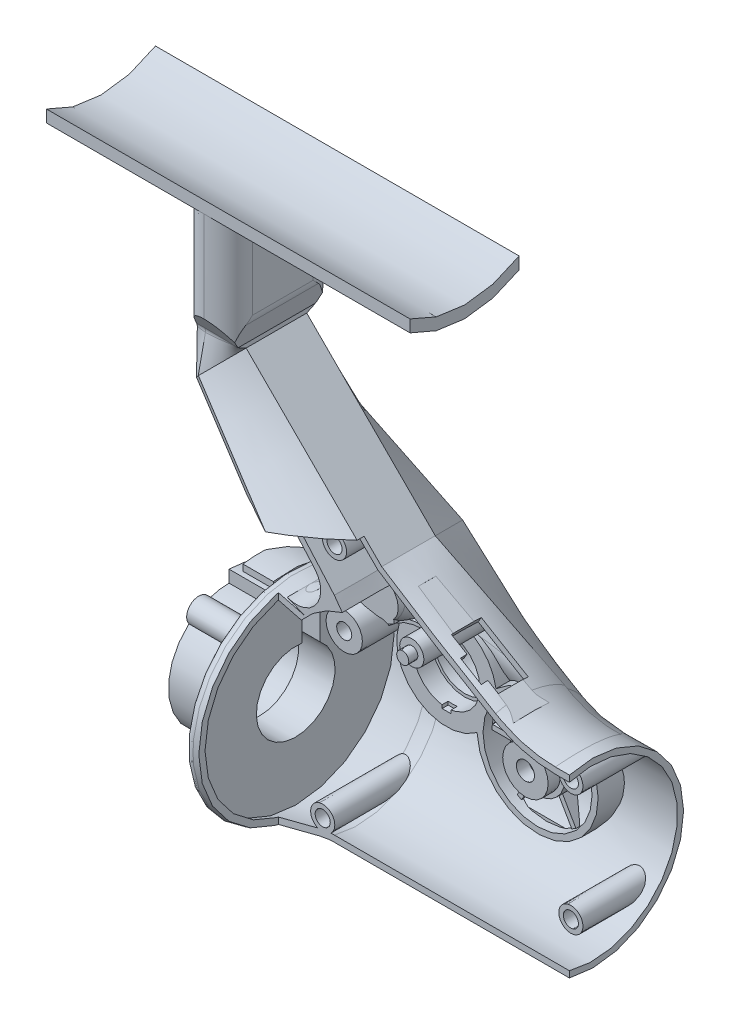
SolidWorks part; units mm, degrees
ref_plane "Plan1" through (0, 0, 0) normal (0, 0, 1) x (1, 0, 0)
ref_plane "Plan2" through (0, 0, 0) normal (0, 1, 0) x (1, 0, 0)
ref_plane "Plan3" through (0, 0, 0) normal (1, 0, 0) x (0, 0, -1)
sketch "Esquisse1" plane through (0, 0, 0) normal (0, 1, 0) x (1, 0, 0)
  line L0 (-80, -50) -> (-80, 50) construction
ref_plane "Plan5" through (-40, 40, 0) normal (-0.7071, 0.7071, 0) x (0, 0, 1)
ref_plane "Plan6" through (-61.2132, 61.2132, 0) normal (-0.7071, 0.7071, 0) x (0, 0, 1)
sketch "Esquisse2" plane through (-61.2132, 61.2132, 0) normal (-0.7071, 0.7071, 0) x (0, 0, 1)
  line L0 (-2.8446, 83.5777) -> (-12.8446, 83.5777)
  line L1 (-1.8446, 73.3764) -> (-13.8446, 73.3764)
  line L2 (-13.8446, 73.3764) -> (-15.3403, 75.977)
  line L3 (-15.3403, 75.977) -> (-12.8446, 83.5777)
  line L4 (-1.8446, 73.3764) -> (-0.3489, 75.977)
  line L5 (-0.3489, 75.977) -> (-2.8446, 83.5777)
  line L6 (-2.8446, 83.5777) -> (-13.8446, 73.3764) construction
  line L7 (-12.8446, 83.5777) -> (-1.8446, 73.3764) construction
  dimension "D1" = 12
  dimension "D2" = 10
  dimension "D3" = 8
  dimension "D4" = 3
  dimension "D5" = 8
  dimension "D6" = 3
sketch "Esquisse3" plane through (-40, 40, 0) normal (-0.7071, 0.7071, 0) x (0, 0, 1)
  line L0 (-2.8446, 83.5777) -> (-12.8446, 83.5777)
  line L1 (-12.8446, 83.5777) -> (-21.218, 78.1109)
  line L2 (-2.8446, 83.5777) -> (5.5288, 78.1109)
  line L3 (5.5288, 78.1109) -> (1.1554, 71.4122)
  line L4 (-21.218, 78.1109) -> (-16.8446, 71.4122)
  line L5 (-16.8446, 71.4122) -> (1.1554, 71.4122)
  line L6 (-2.8446, 83.5777) -> (-16.8446, 71.4122) construction
  line L7 (-12.8446, 83.5777) -> (1.1554, 71.4122) construction
  dimension "D1" = 10
  dimension "D2" = 10
  dimension "D3" = 8
  dimension "D4" = 8
  dimension "D5" = 18
loft "Base-Lissage" add profiles "Esquisse3", "Esquisse2"
ref_plane "Plan7" through (50.07, 0, 0) normal (1, 0, 0) x (0, 0, -1)
ref_plane "Plan8" through (0.07, 0, 0) normal (1, 0, 0) x (0, 0, -1)
sketch "Esquisse4" plane through (50.07, 0, 0) normal (1, 0, 0) x (0, 0, -1)
  circle A0 centre (7.8446, 70.3116) radius 15
  dimension "D1" = 30
  dimension "D2" = 9
  dimension "D3" = 50
sketch "Esquisse5" plane through (0.07, 0, 0) normal (1, 0, 0) x (0, 0, -1)
  circle A0 centre (7.8446, 70.3116) radius 17.5
  dimension "D1" = 35
ref_plane "Plan9" through (-15.2513, 15.2513, 0) normal (-0.7071, 0.7071, 0) x (0, 0, 1)
sketch "Esquisse8" plane through (-40, 40, 0) normal (0.7071, -0.7071, 0) x (0, 0, -1)
  line L0 (2.8446, 83.5777) -> (12.8446, 83.5777)
  line L1 (12.8446, 83.5777) -> (21.218, 78.1109)
  line L2 (2.8446, 83.5777) -> (-5.5288, 78.1109)
  line L3 (-5.5288, 78.1109) -> (-1.1554, 71.4122)
  line L4 (-1.1554, 71.4122) -> (16.8446, 71.4122)
  line L5 (16.8446, 71.4122) -> (21.218, 78.1109)
ref_plane "Plan10" through (10.07, 0, 0) normal (1, 0, 0) x (0, 0, -1)
sketch "Esquisse9" plane through (10.07, 0, 0) normal (1, 0, 0) x (0, 0, -1)
  circle A0 centre (7.8446, 70.3116) radius 15
  dimension "D1" = 30
sketch "Esquisse10" plane through (-40, 40, 0) normal (-0.7071, 0.7071, 0) x (0, 0, 1)
  line L0 (-2.8446, 83.5777) -> (-12.8446, 83.5777)
  line L1 (-2.8446, 83.5777) -> (5.5288, 78.1109)
  line L2 (5.5288, 78.1109) -> (1.1554, 71.4122)
  line L3 (1.1554, 71.4122) -> (-16.8446, 71.4122)
  line L4 (-16.8446, 71.4122) -> (-21.218, 78.1109)
  line L5 (-21.218, 78.1109) -> (-12.8446, 83.5777)
ref_plane "Plan11" through (0, 0, -8) normal (0, 0, 1) x (1, 0, 0)
sketch "Esquisse12" plane through (-15.2513, 15.2513, 0) normal (-0.7071, 0.7071, 0) x (0, 0, 1)
  circle A0 centre (-7.8446, 78.5777) radius 14.1421
  dimension "D1" = 9
  dimension "D2" = 5
loft "Boss.-Lissage1" add profiles "Esquisse12", "Esquisse10"
extrude "Boss.-Extru.2" add sketch "Esquisse9" along normal blind 40
sketch "Esquisse13" plane through (50.07, 0, 0) normal (1, 0, 0) x (0, 0, -1)
  circle A0 centre (7.8446, 70.3116) radius 15.94
extrude "Enlèv. mat.-Extru.1" cut sketch "Esquisse13" along normal blind 50
sketch "Esquisse14" plane through (10.07, 0, 0) normal (-1, 0, 0) x (0, 0, 1)
  circle A0 centre (-7.8446, 70.3116) radius 15
loft "Boss.-Lissage2" add profiles "Esquisse14", "Esquisse5"
fillet "Congé1" radius 10 1 edges at (10.07, 70.3116, 7.1554)
fillet "Congé3" radius 2 1 edges at (14.7265, 86.0336, -17.3)
fillet "Congé5" radius 20 3 edges at (37.8522, 77.0931, 5.5349) (42.6261, 85.2861, -8.7175) (38.4144, 77.6533, -20.925)
fillet "Congé9" radius 3 4 edges at (26.591, 78.6949, -20.2832) (23.0539, 80.0645, 3.5519) (15.967, 83.8004, -17.0589) (36.2035, 75.8986, 6.179)
shell "Coque2" thickness 1
ref_plane "Plan12" through (0, 125, 0) normal (0, 1, 0) x (-1, 0, 0)
ref_plane "Plan13" through (0, 121, 0) normal (0, 1, 0) x (-1, 0, 0)
sketch "Esquisse15" plane through (-61.2132, 61.2132, 0) normal (-0.7071, 0.7071, 0) x (0, 0, 1)
  line L0 (-12.8446, 83.5777) -> (-2.8446, 83.5777)
  line L1 (-2.8446, 83.5777) -> (-0.3343, 75.9412)
  line L2 (-0.3343, 75.9412) -> (-1.5264, 73.7426)
  line L3 (-12.8446, 83.5777) -> (1.1554, 71.4122) construction
  line L4 (-1.5264, 73.7426) -> (-14.1628, 73.7426)
  line L5 (-2.8446, 83.5777) -> (-16.8446, 71.4122) construction
  line L6 (-14.1628, 73.7426) -> (-15.44, 75.9412)
  line L7 (-15.44, 75.9412) -> (-12.8446, 83.5777)
  ellipse E0 centre (-7.8446, 85.1226) end of major axis (-22.8446, 85.1226) minor radius 10.6066 construction
sketch "Esquisse16" plane through (0, 125, 0) normal (0, 1, 0) x (-1, 0, 0)
  line L0 (-50.07, -7.8446) -> (-11.3011, -7.8446) construction
  line L1 (9.0693, -16.8446) -> (1.0693, -16.8446)
  line L2 (9.0693, -16.8446) -> (9.0693, 1.1554)
  line L3 (9.0693, 1.1554) -> (1.0693, 1.1554)
  line L4 (1.0693, -16.8446) -> (1.0693, 1.1554)
  dimension "D1" = 8
  dimension "D2" = 18
  dimension "D3" = 9
  dimension "D4" = 8
sketch "Esquisse17" plane through (0, 121, 0) normal (0, 1, 0) x (-1, 0, 0)
  line L1 (9.0693, -1.5264) -> (2.1241, -1.5264)
  line L2 (9.0693, -1.5264) -> (9.0693, -14.3145)
  line L3 (9.0693, -14.3145) -> (2.1241, -14.3145)
  line L4 (2.1241, -1.5264) -> (2.1241, -14.3145)
loft "Boss.-Lissage5" add profiles "Esquisse15", "Esquisse17"
sketch "Esquisse18" plane through (0, 121, 0) normal (0, 1, 0) x (-1, 0, 0)
  line L0 (9.0693, -16.8446) -> (9.0693, 1.1554) construction
  line L1 (9.0693, -14.3145) -> (2.1241, -14.3145)
  line L2 (9.0693, -14.3145) -> (9.0693, -1.5264)
  line L3 (9.0693, -1.5264) -> (2.1241, -1.5264)
  line L4 (2.1241, -14.3145) -> (2.1241, -1.5264)
loft "Boss.-Lissage6" add profiles "Esquisse18", "Esquisse16"
sketch "Esquisse19" plane through (0, 125, 0) normal (0, 1, 0) x (-1, 0, 0)
  line L1 (9.0693, 1.1554) -> (1.0693, 1.1554)
  line L2 (9.0693, 1.1554) -> (9.0693, -16.8446)
  line L3 (9.0693, -16.8446) -> (1.0693, -16.8446)
  line L4 (1.0693, 1.1554) -> (1.0693, -16.8446)
extrude "Boss.-Extru.6" add sketch "Esquisse19" along normal blind 15
sketch "Esquisse20" plane through (-1.0693, 0, 0) normal (1, 0, 0) x (0, 0, -1)
  line L1 (-1.1554, 140) -> (16.8446, 140) construction
  line L2 (-1.1554, 140) -> (-1.1554, 141.995)
  line L3 (16.8446, 141.995) -> (-1.1554, 141.995)
  line L4 (16.8446, 141.995) -> (16.8446, 140)
  arc A0 (16.8446, 140) -> (-1.1554, 140) centre (7.8446, 155) cw
  dimension "D2" = 18
  dimension "D3" = 15
extrude "Boss.-Extru.7" add sketch "Esquisse20" along normal mid plane 60
sketch "Esquisse21" plane through (28.9307, 0, 0) normal (1, 0, 0) x (0, 0, -1)
  line L1 (-1.1554, 141.995) -> (0, 150)
  line L2 (0, 150) -> (20.3442, 147.0636)
  line L3 (20.3442, 147.0636) -> (16.8446, 141.995)
  arc A0 (16.8446, 141.995) -> (-1.1554, 141.995) centre (7.8446, 156.9022) cw
extrude "Enlèv. mat.-Extru.2" cut sketch "Esquisse21" against normal through all
fillet "Congé32" radius 4 12 edges at (-9.0693, 117.1785, -1.5264) (-5.0693, 125, 1.1554) (-5.0693, 125, -16.8446) (-9.0693, 123, -0.1855) (-9.0693, 123, -15.5795) (-9.0693, 132.5, -16.8446) (-9.0693, 132.5, 1.1554) (-1.0693, 132.5, 1.1554) (-1.0693, 132.5, -16.8446)
fillet "Congé36" radius 1 6 edges at (-5.4568, 121, -14.3145) (-7.3188, 123.9052, -16.1521) (-8.824, 118.4998, -1.4653)
fillet "Congé37" radius 4 2 edges at (-1.0693, 125, -7.8446) (-1.2457, 124.3311, -1.6699)
sketch "Esquisse22" plane through (0.07, 0, 0) normal (-1, 0, 0) x (0, 0, 1)
  circle A0 centre (-7.8446, 70.3116) radius 10
  dimension "D1" = 20
extrude "Boss.-Extru.8" add sketch "Esquisse22" along normal blind 10
sketch "Esquisse23" plane through (-9.93, 0, 0) normal (-1, 0, 0) x (0, 0, 1)
  line L2 (-12.8446, 81.2203) -> (-12.8446, 70.3116)
  line L3 (-12.8446, 70.3116) -> (-7.8446, 70.3116)
  line L4 (-7.8446, 82.3116) -> (-7.8446, 70.3116)
  circle A0 centre (-2.8446, 78.9718) radius 2
  circle A1 centre (-7.8446, 70.3116) radius 10 construction
  circle A2 centre (-12.8446, 61.6513) radius 2
  circle A3 centre (-7.8446, 70.3116) radius 12 construction
  arc A4 (-7.8446, 82.3116) -> (-12.8446, 81.2203) centre (-7.8446, 70.3116) ccw
  dimension "D1" = 4
  dimension "D2" = 4
  dimension "D4" = 24
  dimension "D3" = 5
  dimension "D5" = 5
  dimension "D6" = 5
extrude "Boss.-Extru.9" add sketch "Esquisse23" against normal up to next
sketch "Esquisse24" plane through (-9.93, 0, 0) normal (-1, 0, 0) x (0, 0, 1)
  line L0 (-8.8446, 81.2193) -> (-8.8446, 76.7342)
  line L1 (-11.8446, 81.2193) -> (-8.8446, 81.2193)
  line L2 (-11.8446, 81.2193) -> (-11.8446, 75.435)
  arc A0 (-11.8446, 75.435) -> (-8.8446, 76.7342) centre (-7.8446, 70.3116) ccw
  dimension "D1" = 6.5
  dimension "D3" = 1
  dimension "D4" = 3
  dimension "D5" = 0.001
extrude "Enlèv. mat.-Extru.3" cut sketch "Esquisse24" against normal blind 15
sketch "Esquisse25" plane through (-9.93, 0, 0) normal (-1, 0, 0) x (0, 0, 1)
  circle A0 centre (-2.8446, 78.9718) radius 1.25
  circle A1 centre (-12.8446, 61.6513) radius 1.25
  circle A2 centre (-7.8446, 70.3116) radius 7
  dimension "D1" = 2.5
  dimension "D2" = 2.5
  dimension "D3" = 14
extrude "Enlèv. mat.-Extru.4" cut sketch "Esquisse25" against normal blind 5
fillet "Congé38" radius 1 9 edges at (0.07, 80.1812, -6.2353) (0.07, 80.7039, -1.8446) (0.07, 65.3116, 0.8157) (0.07, 59.9193, -13.8446) (0.07, 71.3116, -17.7945) (0.07, 80.0961, -12.8446) (0.07, 81.3116, -7.8446) (0.07, 82.0356, -10.4034) (0.07, 70.3116, -25.3446)
sketch "Esquisse26" plane through (0.07, 0, 0) normal (-1, 0, 0) x (0, 0, 1)
  line L0 (-5.1428, 86.8918) -> (-5.1428, 85.8478)
  line L1 (-20.9141, 79.1355) -> (-22.1395, 79.1355)
  arc A0 (-5.1428, 86.8918) -> (-22.1395, 79.1355) centre (-7.8446, 70.3116) ccw
  arc A1 (-5.1428, 85.8478) -> (-20.9141, 79.1355) centre (-7.8446, 70.3116) ccw
extrude "Boss.-Extru.10" add sketch "Esquisse26" along normal blind 5
ref_plane "Plan14" through (0, 88.6889, 0) normal (0, 1, 0) x (-1, 0, 0)
sketch "Esquisse27" plane through (0, 88.6889, 0) normal (0, 1, 0) x (-1, 0, 0)
  line L0 (4.93, -8.8446) -> (-0.07, -22.1395)
  line L1 (4.93, -8.8446) -> (4.93, -22.1395)
  line L2 (4.93, -22.1395) -> (-0.07, -22.1395)
  line L3 (4.93, -14.8446) -> (4.93, -0.8446) construction
  point P6 (4.93, -7.8446)
  dimension "D1" = 1
extrude "Enlèv. mat.-Extru.5" cut sketch "Esquisse27" against normal up to surface (35.5975 mm away)
fillet "Congé44" radius 1 1 edges at (-2.3582, 83.995, -15.6828)
sketch "Esquisse28" plane through (0, 0, -8) normal (0, 0, 1) x (1, 0, 0)
  line L0 (1.07, 70.3116) -> (-4.93, 70.3116) construction
  line L1 (1.3125, 53.1222) -> (1.3125, 87.5009) construction
  line L3 (50.07, 70.3116) -> (11.3011, 70.3116) construction
  circle A0 centre (31.3125, 70.3116) radius 4.5
  circle A1 centre (46.3125, 80.3116) radius 2
  circle A2 centre (46.3125, 60.3116) radius 2
  circle A3 centre (11.3125, 98.3116) radius 2
  circle A4 centre (9.3666, 58.3116) radius 2
  circle A5 centre (16.3125, 76.3116) radius 5
  circle A6 centre (46.3125, 80.3116) radius 1.25
  circle A7 centre (46.3125, 60.3116) radius 1.25
  circle A8 centre (9.3666, 58.3116) radius 1.25
  circle A9 centre (11.3125, 98.3116) radius 1.25
  dimension "D1" = 9
  dimension "D3" = 4
  dimension "D4" = 4
  dimension "D7" = 4
  dimension "D8" = 4
  dimension "D14" = 10
  dimension "D17" = 2.5
  dimension "D18" = 2.5
  dimension "D19" = 2.5
  dimension "D20" = 2.5
  dimension "D2" = 30
  dimension "D5" = 20
  dimension "D6" = 15
  dimension "D9" = 28
  dimension "D10" = 15
  dimension "D11" = 10
  dimension "D12" = 20
  dimension "D13" = 12
  dimension "D15" = 6
  dimension "D16" = 15
extrude "Boss.-Extru.12" add sketch "Esquisse28" along normal up to next and the other way up to next
sketch "Esquisse31" plane through (0, 0, -8) normal (0, 0, 1) x (1, 0, 0)
  line L0 (-9.3283, 113.0982) -> (10.496, 90.496) construction
  line L1 (8.8757, 85.6101) -> (1.3125, 87.5009) construction
  line L2 (8.0029, 93.3385) -> (12.9057, 87.9542)
  line L3 (10.496, 90.496) -> (15.3153, 85.4124) construction
  line L4 (3.5116, 86.9512) -> (13.1986, 82.9294)
  line L5 (13.1986, 82.9294) -> (12.8811, 87.4325)
  line L6 (12.9057, 87.9542) -> (12.8811, 87.4325)
  arc A0 (8.0029, 93.3385) -> (3.5116, 86.9512) centre (5.0453, 90.6454) cw
  spline S0 degree 3 poles (16.2369, 80.9616) (15.7292, 81.2771) (15.2385, 81.5873) (14.2964, 82.1941) (13.8431, 82.4898) (13.2062, 82.9231) (13.001, 83.0657) (12.6064, 83.3462) (12.4161, 83.4848) (11.8797, 83.8843) (11.5671, 84.13) (11.3011, 84.3485) knots 0 0 0 0 0.25 0.25 0.5 0.5 0.625 0.625 0.75 0.75 1 1 1 1 construction
  dimension "D1" = 4
extrude "Boss.-Extru.18" add sketch "Esquisse31" along normal mid plane 10
sketch "Esquisse34" plane through (0, 0, -8) normal (0, 0, 1) x (1, 0, 0)
  line L0 (15.6094, 89.7932) -> (15.6094, 84.496)
  line L1 (15.6094, 84.496) -> (6.9254, 76.3356)
  line L2 (6.9254, 76.3356) -> (2.9541, 78.2614)
  arc A0 (15.6094, 89.7932) -> (2.9541, 78.2614) centre (16.3125, 76.3116) ccw
  dimension "D1" = 13.5
extrude "Enlèv. mat.-Extru.6" cut sketch "Esquisse34" against normal mid plane 8
ref_plane "Plan15" through (0, 0, -4) normal (0, 0, 1) x (1, 0, 0)
sketch "Esquisse35" plane through (0, 0, -4) normal (0, 0, 1) x (1, 0, 0)
  line L0 (2.07, 22) -> (2.07, 95.7944)
  line L1 (20.1041, 50.6066) -> (-50.6066, -20.1041) construction
  line L2 (2.07, 22) -> (71.4975, 22)
  line L3 (2.07, 102) -> (-7.4894, 102)
  line L4 (2.07, 102) -> (71.4975, 102)
  line L5 (71.4975, 22) -> (71.4975, 102)
  line L6 (50.07, 55.3116) -> (50.07, 85.3116) construction
  line L7 (-7.4894, 102) -> (-7.4894, 95.7944)
  line L8 (-7.4894, 95.7944) -> (2.07, 95.7944)
  dimension "D1" = 80
  dimension "D2" = 22
  dimension "D3" = 48
extrude "Enlèv. mat.-Extru.7" cut sketch "Esquisse35" along normal blind 23
sketch "Esquisse36" plane through (0, 0, -4) normal (0, 0, 1) x (1, 0, 0)
  circle A0 centre (16.3125, 76.3116) radius 8.25
  dimension "D1" = 16.5
extrude "Boss.-Extru.19" add sketch "Esquisse36" against normal blind 21
sketch "Esquisse37" plane through (0, 0, -4) normal (0, 0, 1) x (1, 0, 0)
  circle A0 centre (16.3125, 76.3116) radius 5
  dimension "D1" = 10
extrude "Enlèv. mat.-Extru.8" cut sketch "Esquisse37" against normal through all
sketch "Esquisse38" plane through (0, 0, -25) normal (0, 0, -1) x (-1, 0, 0)
  circle A0 centre (-16.3125, 76.3116) radius 7
  circle A1 centre (-16.3125, 76.3116) radius 10
  dimension "D1" = 14
  dimension "D2" = 20
extrude "Enlèv. mat.-Extru.9" cut sketch "Esquisse38" against normal blind 2.5
sketch "Esquisse39" plane through (0, 0, -4) normal (0, 0, 1) x (1, 0, 0)
  circle A0 centre (16.3125, 76.3116) radius 8.25
  dimension "D1" = 16.5
extrude "Enlèv. mat.-Extru.10" cut sketch "Esquisse39" against normal blind 8
sketch "Esquisse40" plane through (0, 0, -12) normal (0, 0, 1) x (1, 0, 0)
  circle A0 centre (16.3125, 76.3116) radius 8
  dimension "D1" = 16
extrude "Enlèv. mat.-Extru.12" cut sketch "Esquisse40" against normal blind 5.5
sketch "Esquisse41" plane through (0, 0, -12) normal (0, 0, 1) x (1, 0, 0)
  circle A0 centre (16.3125, 76.3116) radius 8.25
extrude "Enlèv. mat.-Extru.13" cut sketch "Esquisse41" against normal up to surface (5.5 mm away)
sketch "Esquisse42" plane through (0, 0, -17.5) normal (0, 0, 1) x (1, 0, 0)
  line L0 (16.0604, 84.5577) -> (16.3125, 84.0668)
  line L1 (10.8055, 81.772) -> (10.4365, 82.1025)
  arc A0 (16.0604, 84.5577) -> (10.4365, 82.1025) centre (16.006, 77.0137) ccw
  arc A2 (16.3125, 84.0668) -> (10.8055, 81.772) centre (16.3125, 76.3116) ccw
  arc A5 (10.2144, 81.8681) -> (9.3236, 80.6953) centre (16.3125, 76.3116) ccw construction
extrude "Boss.-Extru.22" add sketch "Esquisse42" along normal blind 4
sketch "Esquisse43" plane through (0, 0, -4) normal (0, 0, 1) x (1, 0, 0)
  line L0 (50.07, 70.3116) -> (11.3011, 70.3116) construction
  circle A0 centre (31.3125, 70.3116) radius 4.5
extrude "Enlèv. mat.-Extru.14" cut sketch "Esquisse43" against normal up to surface (13.5 mm away)
sketch "Esquisse44" plane through (0, 0, -17.5) normal (0, 0, 1) x (1, 0, 0)
  circle A0 centre (31.3125, 70.3116) radius 10
  circle A1 centre (31.3125, 70.3116) radius 9
  dimension "D1" = 20
  dimension "D2" = 18
extrude "Boss.-Extru.23" add sketch "Esquisse44" against normal up to surface (4.3446 mm away)
sketch "Esquisse45" plane through (0, 0, -17.5) normal (0, 0, 1) x (1, 0, 0)
  line L0 (50.07, 70.3116) -> (11.3011, 70.3116) construction
  line L1 (35.7947, 70.7116) -> (41.3045, 70.7116)
  line L2 (35.7947, 70.7116) -> (35.7947, 69.9116)
  line L3 (35.7947, 69.9116) -> (41.3045, 69.9116)
  line L4 (41.3045, 70.7116) -> (41.3045, 69.9116)
  circle A1 centre (31.3125, 70.3116) radius 4.5 construction
  arc A2 (21.3277, 69.761) -> (24.4619, 77.5964) centre (31.3125, 70.3116) ccw construction
  dimension "D1" = 0.8
  dimension "D2" = 0.4
extrude "Boss.-Extru.24" add sketch "Esquisse45" against normal up to surface (1.5044 mm away)
pattern_circular "Répétition circulaire1" count 6 every 60 about axis through (31.3125, 70.3116, 0) along (0, 0, 1) of "Boss.-Extru.24"
sketch "Esquisse46" plane through (0, 0, -17.5) normal (0, 0, 1) x (1, 0, 0)
  circle A0 centre (31.3125, 70.3116) radius 3.75
  circle A1 centre (31.3125, 70.3116) radius 1.5
  dimension "D1" = 7.5
  dimension "D2" = 3
extrude "Boss.-Extru.25" add sketch "Esquisse46" along normal blind 2
sketch "Esquisse48" plane through (0, 0, -11.8446) normal (0, 0, 1) x (1, 0, 0)
  line L0 (-0.93, 78.9718) -> (-9.93, 78.9718) construction
  circle A0 centre (5.07, 78.9718) radius 3
  circle A1 centre (5.07, 78.9718) radius 1.25
  dimension "D1" = 6
  dimension "D2" = 2.5
  dimension "D3" = 15
extrude "Boss.-Extru.27" add sketch "Esquisse48" against normal up to next
sketch "Esquisse49" plane through (0, 0, -17.5) normal (0, 0, 1) x (1, 0, 0)
  circle A0 centre (16.3125, 76.3116) radius 5.5
  dimension "D1" = 11
extrude "Enlèv. mat.-Extru.15" cut sketch "Esquisse49" against normal blind 3
sketch "Esquisse50" plane through (0, 0, -17.5) normal (0, 0, 1) x (1, 0, 0)
  line L1 (17.0625, 82.3116) -> (15.5625, 82.3116)
  line L2 (17.0625, 82.3116) -> (17.0625, 70.3116)
  line L3 (17.0625, 70.3116) -> (15.5625, 70.3116)
  line L4 (15.5625, 82.3116) -> (15.5625, 70.3116)
  dimension "D1" = 1.5
  dimension "D2" = 12
  dimension "D3" = 6
  dimension "D4" = 0.75
extrude "Enlèv. mat.-Extru.16" cut sketch "Esquisse50" against normal blind 1
sketch "Esquisse51" plane through (0, 0, -17.5) normal (0, 0, 1) x (1, 0, 0)
  circle A0 centre (31.3125, 70.3116) radius 9
  circle A1 centre (31.3125, 70.3116) radius 4.5
extrude "Enlèv. mat.-Extru.17" cut sketch "Esquisse51" against normal blind 1.5
sketch "Esquisse52" plane through (0, 0, -8) normal (0, 0, 1) x (1, 0, 0)
  line L0 (50.07, 70.3116) -> (11.3011, 70.3116) construction
  circle A0 centre (20.07, 85.3116) radius 2
  dimension "D1" = 4
  dimension "D2" = 15
  dimension "D3" = 15
extrude "Boss.-Extru.28" add sketch "Esquisse52" against normal up to next
sketch "Esquisse53" plane through (0, 0, -8) normal (0, 0, 1) x (1, 0, 0)
  circle A1 centre (20.07, 85.3116) radius 1
  dimension "D1" = 2
ref_plane "Plan16" through (48.533, 81.5893, 0) normal (-0.5112, -0.8594, 0) x (0.8594, -0.5112, 0)
sketch "Esquisse55" plane through (48.533, 81.5893, 0) normal (-0.5112, -0.8594, 0) x (0.8594, -0.5112, 0)
  line L1 (-30, -11.8446) -> (-10, -11.8446)
  line L2 (-30, -11.8446) -> (-30, -3.8446)
  line L3 (-30, -3.8446) -> (-10, -3.8446)
  line L4 (-10, -11.8446) -> (-10, -3.8446)
  line L5 (-35.0261, -7.8446) -> (-28.526, -7.8446) construction
  dimension "D1" = 8
  dimension "D2" = 20
  dimension "D3" = 4
extrude "Enlèv. mat.-Extru.19" cut sketch "Esquisse55" against normal blind 0.8
sketch "Esquisse57" plane through (48.533, 81.5893, 0) normal (0.5112, 0.8594, 0) x (-0.8594, 0.5112, 0)
  line L0 (24.9934, -26.3576) -> (24.9934, -22.2848) construction
  line L1 (22.9934, -10.8446) -> (13.9934, -10.8446)
  line L2 (22.9934, -10.8446) -> (22.9934, -5.8446)
  line L3 (22.9934, -5.8446) -> (13.9934, -5.8446)
  line L4 (13.9934, -10.8446) -> (13.9934, -5.8446)
  line L5 (35.0261, -7.8446) -> (40.1827, -7.8446) construction
  dimension "D1" = 5
  dimension "D2" = 9
  dimension "D3" = 2
  dimension "D4" = 2
extrude "Enlèv. mat.-Extru.20" cut sketch "Esquisse57" against normal blind 2.2
sketch "Esquisse58" plane through (48.533, 81.5893, 0) normal (0.5112, 0.8594, 0) x (-0.8594, 0.5112, 0)
  line L0 (15.3556, -5.8446) -> (22.9934, -5.8446) construction
  line L1 (20.0073, -5.8446) -> (16.0073, -5.8446)
  line L2 (20.0073, -5.8446) -> (20.0073, -4.8446)
  line L3 (20.0073, -4.8446) -> (16.0073, -4.8446)
  line L4 (16.0073, -5.8446) -> (16.0073, -4.8446)
  dimension "D1" = 4
  dimension "D2" = 3
  dimension "D3" = 1
extrude "Enlèv. mat.-Extru.21" cut sketch "Esquisse58" against normal blind 2.2
extrude "Boss.-Extru.29" add sketch "Esquisse53" along normal blind 1.5
sketch "Esquisse59" plane through (0, 0, -4) normal (0, 0, 1) x (1, 0, 0)
  circle A0 centre (46.3125, 80.3116) radius 2
  circle A1 centre (46.3125, 60.3116) radius 2
extrude "Enlèv. mat.-Extru.22" cut sketch "Esquisse59" against normal blind 4
